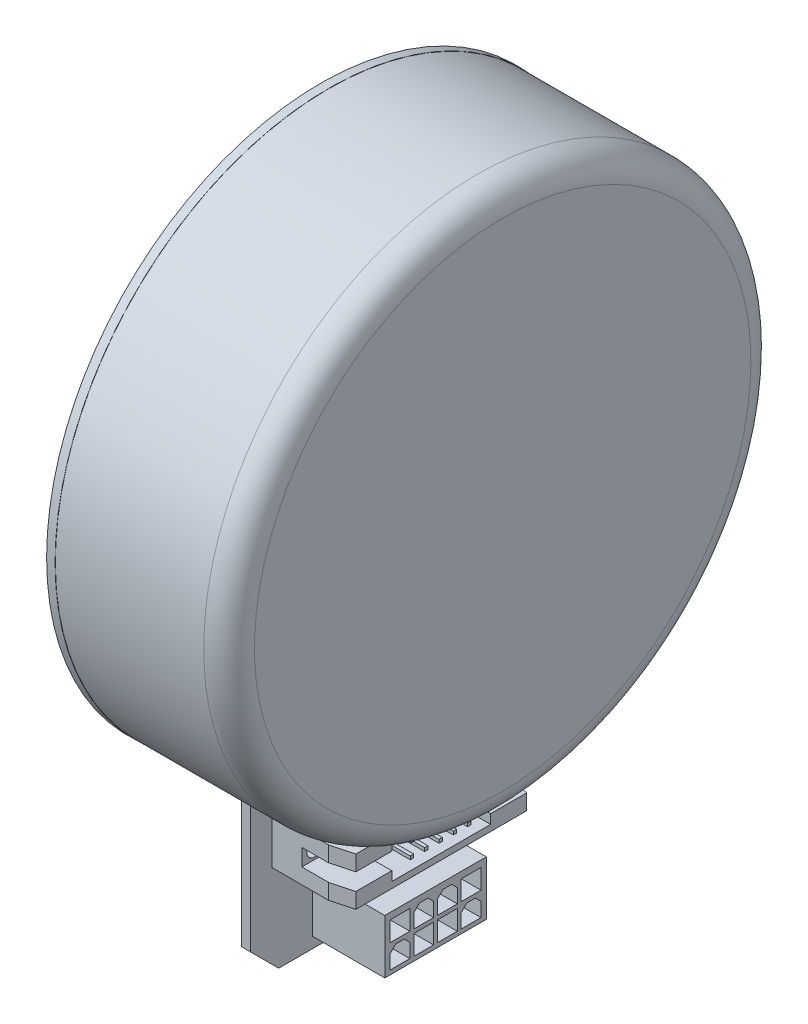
SolidWorks part; units mm, degrees
ref_plane "Front Plane" through (0, 0, 0) normal (0, 0, 1) x (1, 0, 0)
ref_plane "Top Plane" through (0, 0, 0) normal (0, 1, 0) x (1, 0, 0)
ref_plane "Right Plane" through (0, 0, 0) normal (1, 0, 0) x (0, 0, -1)
ref_plane "Plane1" through (7.6, 0, 0) normal (1, 0, 0) x (0, 0, -1)
sketch "Sketch1" plane through (7.6, 0, 0) normal (1, 0, 0) x (0, 0, -1)
  line L0 (-20, -44.1843) -> (20, -44.1843)
  arc A0 (20, -44.1843) -> (-20, -44.1843) centre (0, 0) ccw
extrude "Boss-Extrude1" add sketch "Sketch1" against normal blind 1.6
sketch "Sketch2" plane through (0, -44.1843, 0) normal (0, -1, 0) x (1, 0, 0)
  line L0 (7.6, 20) -> (7.6, -20)
  line L1 (7.6, -20) -> (6, -20)
  line L2 (6, -20) -> (6, 20)
  line L3 (6, 20) -> (7.6, 20)
extrude "Boss-Extrude2" add sketch "Sketch2" along normal blind 31.3157
sketch "Sketch3" plane through (7.6, 0, 0) normal (1, 0, 0) x (0, 0, -1)
  line L0 (-20, -51.5) -> (20, -51.5)
  line L1 (20, -51.5) -> (20, -75.5)
  line L2 (20, -75.5) -> (-20, -75.5)
  line L3 (-20, -75.5) -> (-20, -51.5)
extrude "Boss-Extrude3" add sketch "Sketch3" along normal blind 12.8
ref_plane "Plane2" through (0, 0, -1.7) normal (0, 0, -1) x (-1, 0, 0)
sketch "Sketch4" plane through (0, 0, -1.7) normal (0, 0, -1) x (-1, 0, 0)
  line L0 (-18.4, -75.5) -> (-20.4, -74.1)
  line L1 (-20.4, -74.1) -> (-20.4, -75.5)
  line L2 (-20.4, -75.5) -> (-18.4, -75.5)
extrude "Cut-Extrude1" cut sketch "Sketch4" against normal blind 3.4
sketch "Sketch5" plane through (0, -75.5, 0) normal (0, -1, 0) x (1, 0, 0)
  line L0 (20.4, 1.7) -> (20.4, 20)
  line L1 (20.4, 20) -> (6, 20)
  line L2 (6, 20) -> (6, -20)
  line L3 (6, -20) -> (20.4, -20)
  line L4 (20.4, -20) -> (20.4, -1.7)
  line L5 (20.4, -1.7) -> (17.4, -1.7)
  line L6 (17.4, -1.7) -> (17.4, 1.7)
  line L7 (17.4, 1.7) -> (20.4, 1.7)
extrude "Cut-Extrude2" cut sketch "Sketch5" against normal blind 1.4
sketch "Sketch6" plane through (20.4, 0, 0) normal (1, 0, 0) x (0, 0, -1)
  line L0 (-20, -51.5) -> (20, -51.5)
  line L1 (20, -51.5) -> (20, -74.1)
  line L2 (20, -74.1) -> (-20, -74.1)
  line L3 (-20, -74.1) -> (-20, -51.5)
extrude "Boss-Extrude4" add sketch "Sketch6" along normal blind 1
sketch "Sketch7" plane through (7.6, 0, 0) normal (1, 0, 0) x (0, 0, -1)
  circle A0 centre (0, 0) radius 48.5
extrude "Boss-Extrude5" add sketch "Sketch7" along normal blind 24.7
sketch "Sketch8" plane through (6, 0, 0) normal (-1, 0, 0) x (0, 0, 1)
  line L0 (-20.1, -42.4852) -> (-20.1, -44.1389)
  line L1 (20.1, -44.1389) -> (20.1, -42.4852)
  arc A0 (20.1, -42.4852) -> (-20.1, -42.4852) centre (0, 0) cw
  arc A1 (-20.1, -44.1389) -> (20.1, -44.1389) centre (0, 0) cw
extrude "Boss-Extrude6" add sketch "Sketch8" along normal blind 4.5
sketch "Sketch9" plane through (6, 0, 0) normal (-1, 0, 0) x (0, 0, 1)
  line L0 (-20, -44.1843) -> (-20, -42.5323)
  line L1 (-20.1, -42.4852) -> (-20.1, -44.1389)
  arc A0 (-20.1, -44.1389) -> (-20, -44.1843) centre (0, 0) ccw
  arc A1 (-20, -42.5323) -> (-20.1, -42.4852) centre (0, 0) cw
extrude "Cut-Extrude3" cut sketch "Sketch9" against normal blind 1.6
sketch "Sketch10" plane through (6, 0, 0) normal (-1, 0, 0) x (0, 0, 1)
  line L0 (20, -42.5323) -> (20, -44.1843)
  line L1 (20.1, -44.1389) -> (20.1, -42.4852)
  arc A0 (20, -44.1843) -> (20.1, -44.1389) centre (0, 0) ccw
  arc A1 (20.1, -42.4852) -> (20, -42.5323) centre (0, 0) cw
extrude "Cut-Extrude4" cut sketch "Sketch10" against normal blind 1.6
sketch "Sketch11" plane through (7.6, 0, 0) normal (-1, 0, 0) x (0, 0, 1)
  line L0 (20.1, -44.1389) -> (20.1, -42.4852)
  line L1 (-20.1, -42.4852) -> (-20.1, -44.1389)
  arc A0 (20.1, -42.4852) -> (-20.1, -42.4852) centre (0, 0) cw
  arc A1 (-20.1, -44.1389) -> (20.1, -44.1389) centre (0, 0) ccw
extrude "Cut-Extrude5" cut sketch "Sketch11" against normal blind 0.7
sketch "Sketch12" plane through (0, -51.5, 0) normal (0, 1, 0) x (-1, 0, 0)
  line L0 (-7.6, 3.135) -> (-7.6, 4.485)
  line L1 (-7.6, 4.485) -> (-16.525, 4.485)
  line L2 (-16.525, 3.135) -> (-7.6, 3.135)
  arc A0 (-16.525, 4.485) -> (-16.525, 3.135) centre (-16.525, 3.81) ccw
extrude "Cut-Extrude6" cut sketch "Sketch12" against normal blind 1.1
ref_plane "Plane3" through (0, -52.6, 0) normal (0, 1, 0) x (1, 0, 0)
sketch "Sketch13" plane through (0, -52.6, 0) normal (0, 1, 0) x (1, 0, 0)
  line L0 (15, 8.765) -> (15, -4.485)
  line L1 (15, -4.485) -> (21.4, -4.485)
  line L2 (21.4, -4.485) -> (21.4, 8.765)
  line L3 (21.4, 8.765) -> (15, 8.765)
extrude "Cut-Extrude7" cut sketch "Sketch13" against normal blind 0.9
sketch "Sketch14" plane through (0, 0, 4.485) normal (0, 0, -1) x (-1, 0, 0)
  line L0 (-21.4, -52.6) -> (-21.4, -53.5)
  line L1 (-21.4, -53.5) -> (-15, -53.5)
  line L2 (-15, -53.5) -> (-15, -52.6)
  line L3 (-15, -52.6) -> (-21.4, -52.6)
extrude "Cut-Extrude8" cut sketch "Sketch14" against normal blind 4.28
sketch "Sketch15" plane through (0, 0, 4.485) normal (0, 0, -1) x (-1, 0, 0)
  line L0 (-12.6, -51.5) -> (-12.6, -52.6)
  line L1 (-12.6, -52.6) -> (-7.6, -52.6)
  line L2 (-7.6, -52.6) -> (-7.6, -51.5)
  line L3 (-7.6, -51.5) -> (-12.6, -51.5)
extrude "Cut-Extrude9" cut sketch "Sketch15" against normal blind 2.515
sketch "Sketch16" plane through (0, 0, 3.135) normal (0, 0, 1) x (1, 0, 0)
  line L0 (7.6, -52.6) -> (12.6, -52.6)
  line L1 (12.6, -52.6) -> (12.6, -51.5)
  line L2 (12.6, -51.5) -> (7.6, -51.5)
  line L3 (7.6, -51.5) -> (7.6, -52.6)
extrude "Cut-Extrude10" cut sketch "Sketch16" against normal blind 10.135
sketch "Sketch17" plane through (0, 0, 3.135) normal (0, 0, 1) x (1, 0, 0)
  line L0 (14.2, -52.6) -> (14.2, -51.5)
  line L1 (14.2, -51.5) -> (12.6, -51.5)
  line L2 (12.6, -51.5) -> (12.6, -52.6)
  line L3 (12.6, -52.6) -> (14.2, -52.6)
extrude "Cut-Extrude11" cut sketch "Sketch17" against normal blind 1.085
sketch "Sketch18" plane through (0, 0, 2.05) normal (0, 0, 1) x (1, 0, 0)
  line L0 (21.4, -51.5) -> (12.6, -51.5)
  line L1 (12.6, -51.5) -> (12.6, -52.6)
  line L2 (12.6, -52.6) -> (14, -52.6)
  line L3 (14, -52.6) -> (14, -53.5)
  line L4 (14, -53.5) -> (15, -53.5)
  line L5 (15, -53.5) -> (15, -52.6)
  line L6 (15, -52.6) -> (21.4, -52.6)
  line L7 (21.4, -52.6) -> (21.4, -51.5)
extrude "Cut-Extrude12" cut sketch "Sketch18" against normal blind 0.24
sketch "Sketch19" plane through (0, 0, 1.81) normal (0, 0, 1) x (1, 0, 0)
  line L0 (14, -51.5) -> (14, -53.5)
  line L1 (14, -53.5) -> (15, -53.5)
  line L2 (15, -53.5) -> (15, -52.6)
  line L3 (15, -52.6) -> (21.4, -52.6)
  line L4 (21.4, -52.6) -> (21.4, -51.5)
  line L5 (21.4, -51.5) -> (14, -51.5)
extrude "Cut-Extrude13" cut sketch "Sketch19" against normal blind 3.86
sketch "Sketch20" plane through (0, -53.5, 0) normal (0, 1, 0) x (-1, 0, 0)
  line L0 (-21.4, 8.765) -> (-21.4, -8.765)
  line L1 (-21.4, -8.765) -> (-15, -8.765)
  line L2 (-15, -8.765) -> (-15, 8.765)
  line L3 (-15, 8.765) -> (-21.4, 8.765)
extrude "Cut-Extrude14" cut sketch "Sketch20" against normal blind 0.75
sketch "Sketch21" plane through (0, -54.25, 0) normal (0, 1, 0) x (-1, 0, 0)
  line L0 (-15, -6.45) -> (-15, 8.765)
  line L1 (-15, 8.765) -> (-21.4, 8.765)
  line L2 (-21.4, 8.765) -> (-21.4, -20)
  line L3 (-21.4, -20) -> (-12.85, -20)
  line L4 (-12.85, -20) -> (-12.85, -6.45)
  line L5 (-12.85, -6.45) -> (-15, -6.45)
extrude "Cut-Extrude15" cut sketch "Sketch21" against normal blind 3
ref_plane "Plane4" through (0, -57.25, 0) normal (0, -1, 0) x (1, 0, 0)
sketch "Sketch22" plane through (0, -57.25, 0) normal (0, -1, 0) x (1, 0, 0)
  line L0 (12.85, 13.7429) -> (12.85, 6.45)
  line L1 (12.85, 6.45) -> (15, 6.45)
  line L2 (15, 6.45) -> (15, 8.765)
  line L3 (15, 8.765) -> (21.4, 8.765)
  line L4 (21.4, 8.765) -> (21.4, 20)
  line L5 (21.4, 20) -> (12.85, 20)
  line L6 (12.85, 16.15) -> (12.85, 14.1972)
  spline S0 degree 3 poles (12.85, 20) (12.85, 18.7167) (12.85, 17.4333) (12.85, 16.15) knots 0 0 0 0 1 1 1 1
  spline S1 degree 3 poles (12.85, 14.1972) (12.85, 14.0457) (12.85, 13.8943) (12.85, 13.7429) knots 0 0 0 0 1 1 1 1
extrude "Cut-Extrude16" cut sketch "Sketch22" against normal blind 3
sketch "Sketch23" plane through (0, -52.6, 0) normal (0, 1, 0) x (-1, 0, 0)
  line L0 (-12.6, -7) -> (-7.6, -7)
  line L1 (-7.6, -7) -> (-7.6, 7)
  line L2 (-7.6, 7) -> (-12.6, 7)
  line L3 (-12.6, 7) -> (-12.6, -7)
extrude "Cut-Extrude17" cut sketch "Sketch23" against normal blind 0.1
sketch "Sketch24" plane through (0, -51.5, 0) normal (0, 1, 0) x (-1, 0, 0)
  line L0 (-11.9551, 8.32) -> (-7.6, 8.32)
  line L1 (-7.6, 8.32) -> (-7.6, 13.52)
  line L2 (-7.6, 13.52) -> (-11.9551, 13.52)
  line L3 (-11.9551, 13.52) -> (-13.4562, 10.92)
  line L4 (-13.4562, 10.92) -> (-11.9551, 8.32)
extrude "Cut-Extrude18" cut sketch "Sketch24" against normal blind 1.7
sketch "Sketch25" plane through (0, -51.5, 0) normal (0, 1, 0) x (-1, 0, 0)
  line L0 (-11.9551, -13.52) -> (-7.6, -13.52)
  line L1 (-7.6, -13.52) -> (-7.6, -8.32)
  line L2 (-7.6, -8.32) -> (-11.9551, -8.32)
  line L3 (-11.9551, -8.32) -> (-13.4562, -10.92)
  line L4 (-13.4562, -10.92) -> (-11.9551, -13.52)
extrude "Cut-Extrude19" cut sketch "Sketch25" against normal blind 1.7
sketch "Sketch26" plane through (0, 0, -20) normal (0, 0, -1) x (-1, 0, 0)
  line L0 (-7.6, -51.5) -> (-21.4, -51.5)
  line L1 (-21.4, -51.5) -> (-21.4, -54.25)
  line L2 (-21.4, -54.25) -> (-12.85, -54.25)
  line L3 (-12.85, -54.25) -> (-12.85, -57.25)
  line L4 (-12.85, -57.25) -> (-21.4, -57.25)
  line L5 (-21.4, -57.25) -> (-21.4, -74.1)
  line L6 (-21.4, -74.1) -> (-7.6, -74.1)
  line L7 (-7.6, -74.1) -> (-7.6, -51.5)
extrude "Cut-Extrude20" cut sketch "Sketch26" against normal blind 3.85
sketch "Sketch27" plane through (0, -51.5, 0) normal (0, 1, 0) x (-1, 0, 0)
  line L0 (-21.4, 5.81) -> (-21.4, 2.05)
  line L1 (-21.4, 2.05) -> (-14.2, 2.05)
  line L2 (-14.2, 2.05) -> (-14.2, 3.135)
  line L3 (-14.2, 3.135) -> (-16.525, 3.135)
  line L4 (-16.525, 4.485) -> (-14.2, 4.485)
  line L5 (-12.6, 4.485) -> (-12.6, 5.81)
  line L6 (-12.6, 5.81) -> (-21.4, 5.81)
  arc A0 (-16.525, 3.135) -> (-16.525, 4.485) centre (-16.525, 3.81) cw
  spline S0 degree 3 poles (-12.6, 4.485) (-13.1333, 4.485) (-13.6667, 4.485) (-14.2, 4.485) knots 0 0 0 0 1 1 1 1
extrude "Cut-Extrude21" cut sketch "Sketch27" against normal blind 0.4
sketch "Sketch28" plane through (0, 0, 20) normal (0, 0, 1) x (1, 0, 0)
  line L0 (12.85, -54.25) -> (21.4, -54.25)
  line L1 (21.4, -54.25) -> (21.4, -51.5)
  line L2 (21.4, -51.5) -> (7.6, -51.5)
  line L3 (7.6, -51.5) -> (7.6, -74.1)
  line L4 (7.6, -74.1) -> (21.4, -74.1)
  line L5 (21.4, -74.1) -> (21.4, -57.25)
  line L6 (21.4, -57.25) -> (12.85, -57.25)
  line L7 (12.85, -57.25) -> (12.85, -54.25)
extrude "Cut-Extrude22" cut sketch "Sketch28" against normal blind 3.85
sketch "Sketch29" plane through (0, -74.1, 0) normal (0, -1, 0) x (1, 0, 0)
  line L0 (7.6, 9) -> (20.4, 9)
  line L1 (20.4, 9) -> (20.4, -9)
  line L2 (20.4, -9) -> (7.6, -9)
  line L3 (7.6, -9) -> (7.6, -16.15)
  line L4 (7.6, -16.15) -> (21.4, -16.15)
  line L5 (21.4, -16.15) -> (21.4, 16.15)
  line L6 (21.4, 16.15) -> (7.6, 16.15)
  line L7 (7.6, 16.15) -> (7.6, 9)
extrude "Cut-Extrude23" cut sketch "Sketch29" against normal blind 9.6
ref_plane "Plane5" through (0, -58.52, 0) normal (0, 1, 0) x (1, 0, 0)
sketch "Sketch30" plane through (0, -58.52, 0) normal (0, 1, 0) x (1, 0, 0)
  line L0 (7.6, -7.5) -> (12.7, -7.5)
  line L1 (12.7, -7.5) -> (12.7, 7.5)
  line L2 (12.7, 7.5) -> (7.6, 7.5)
  line L3 (7.6, 7.5) -> (7.6, -7.5)
extrude "Cut-Extrude24" cut sketch "Sketch30" against normal blind 5.98
sketch "Sketch31" plane through (0, -64.5, 0) normal (0, -1, 0) x (1, 0, 0)
  line L0 (7.6, 16.15) -> (7.6, 7.5)
  line L1 (7.6, 7.5) -> (12.7, 7.5)
  line L2 (12.7, 7.5) -> (12.7, -7.5)
  line L3 (12.7, -7.5) -> (7.6, -7.5)
  line L4 (7.6, -7.5) -> (7.6, -16.15)
  line L5 (7.6, -16.15) -> (21.4, -16.15)
  line L6 (21.4, -16.15) -> (21.4, 16.15)
  line L7 (21.4, 16.15) -> (7.6, 16.15)
extrude "Cut-Extrude25" cut sketch "Sketch31" against normal blind 4.5
sketch "Sketch32" plane through (0, -74.1, 0) normal (0, -1, 0) x (1, 0, 0)
  line L0 (6, -20) -> (6, 20)
  line L1 (6, 20) -> (7.6, 20)
  line L2 (7.6, 20) -> (7.6, -20)
  line L3 (7.6, -20) -> (6, -20)
extrude "Boss-Extrude7" add sketch "Sketch32" along normal blind 1.9
ref_plane "Plane6" through (1.5, 0, 0) normal (1, 0, 0) x (0, 0, -1)
sketch "Sketch33" plane through (1.5, 0, 0) normal (1, 0, 0) x (0, 0, -1)
  circle A0 centre (0, 0) radius 48.55
extrude "Boss-Extrude8" add sketch "Sketch33" against normal blind 1.5
sketch "Sketch34" plane through (0, -54.25, 0) normal (0, -1, 0) x (1, 0, 0)
  line L0 (12.85, -12.95) -> (12.85, -6.45)
  line L1 (12.85, -6.45) -> (13.6, -6.45)
  line L2 (13.6, -6.45) -> (13.6, -12.95)
  line L3 (13.6, -12.95) -> (12.85, -12.95)
extrude "Boss-Extrude9" add sketch "Sketch34" along normal blind 3
sketch "Sketch35" plane through (13.6, 0, 0) normal (1, 0, 0) x (0, 0, -1)
  line L0 (6.45, -54.25) -> (6.45, -57.25)
  line L1 (6.45, -57.25) -> (9.65, -57.25)
  line L2 (9.65, -57.25) -> (9.65, -54.25)
  line L3 (9.65, -54.25) -> (6.45, -54.25)
extrude "Cut-Extrude26" cut sketch "Sketch35" against normal blind 1.25
sketch "Sketch36" plane through (0, -57.25, 0) normal (0, 1, 0) x (-1, 0, 0)
  line L0 (-13.6, 12.95) -> (-12.85, 12.95)
  line L1 (-12.85, 12.95) -> (-12.85, 6.45)
  line L2 (-12.85, 6.45) -> (-13.6, 6.45)
  line L3 (-13.6, 6.45) -> (-13.6, 12.95)
extrude "Boss-Extrude10" add sketch "Sketch36" along normal blind 3
sketch "Sketch37" plane through (13.6, 0, 0) normal (1, 0, 0) x (0, 0, -1)
  line L0 (-6.45, -54.25) -> (-11.75, -54.25)
  line L1 (-11.75, -54.25) -> (-11.75, -57.25)
  line L2 (-11.75, -57.25) -> (-6.45, -57.25)
  line L3 (-6.45, -57.25) -> (-6.45, -54.25)
extrude "Cut-Extrude27" cut sketch "Sketch37" against normal blind 1.25
sketch "Sketch38" plane through (12.6, 0, 0) normal (-1, 0, 0) x (0, 0, 1)
  line L0 (5.81, -52.6) -> (5.81, -51.9)
  line L1 (5.81, -51.9) -> (4.485, -51.9)
  line L2 (4.485, -51.9) -> (4.485, -52.6)
  line L3 (4.485, -52.6) -> (5.81, -52.6)
extrude "Cut-Extrude28" cut sketch "Sketch38" against normal blind 1.6
sketch "Sketch39" plane through (0, -57.25, 0) normal (0, 1, 0) x (-1, 0, 0)
  line L0 (-15, -8.765) -> (-15, 8.765)
  line L1 (-15, 8.765) -> (-21.4, 8.765)
  line L2 (-21.4, 8.765) -> (-21.4, -8.765)
  line L3 (-21.4, -8.765) -> (-15, -8.765)
extrude "Cut-Extrude29" cut sketch "Sketch39" against normal blind 1.65
sketch "Sketch40" plane through (0, -51.9, 0) normal (0, 1, 0) x (-1, 0, 0)
  line L0 (-21.4, 2.81) -> (-20.4, 2.81)
  line L1 (-20.4, 2.81) -> (-20.4, 4.81)
  line L2 (-20.4, 4.81) -> (-21.4, 4.81)
  line L3 (-21.4, 4.81) -> (-21.4, 2.81)
extrude "Cut-Extrude30" cut sketch "Sketch40" against normal up to next
sketch "Sketch41" plane through (20.4, 0, 0) normal (1, 0, 0) x (0, 0, -1)
  line L0 (-8.05, -69.15) -> (-4.55, -69.15)
  line L1 (-4.55, -69.15) -> (-4.55, -65.65)
  line L2 (-4.55, -65.65) -> (-8.05, -65.65)
  line L3 (-8.05, -65.65) -> (-8.05, -69.15)
extrude "Cut-Extrude31" cut sketch "Sketch41" against normal blind 12.8
sketch "Sketch42" plane through (7.6, 0, 0) normal (1, 0, 0) x (0, 0, -1)
  line L0 (-5.8151, -67.9698) -> (-6.7849, -67.9698)
  line L1 (-6.7849, -67.9698) -> (-6.7849, -67)
  line L2 (-6.7849, -67) -> (-5.8151, -67)
  line L3 (-5.8151, -67) -> (-5.8151, -67.9698)
extrude "Boss-Extrude11" add sketch "Sketch42" along normal blind 3
sketch "Sketch43" plane through (20.4, 0, 0) normal (1, 0, 0) x (0, 0, -1)
  line L0 (4.55, -69.15) -> (8.05, -69.15)
  line L1 (8.05, -69.15) -> (8.05, -65.65)
  line L2 (8.05, -65.65) -> (4.55, -65.65)
  line L3 (4.55, -65.65) -> (4.55, -69.15)
extrude "Cut-Extrude32" cut sketch "Sketch43" against normal blind 12.8
sketch "Sketch44" plane through (7.6, 0, 0) normal (1, 0, 0) x (0, 0, -1)
  line L0 (6.7849, -67.9698) -> (5.8151, -67.9698)
  line L1 (5.8151, -67.9698) -> (5.8151, -67)
  line L2 (5.8151, -67) -> (6.7849, -67)
  line L3 (6.7849, -67) -> (6.7849, -67.9698)
extrude "Boss-Extrude12" add sketch "Sketch44" along normal blind 3
sketch "Sketch45" plane through (20.4, 0, 0) normal (1, 0, 0) x (0, 0, -1)
  line L0 (-3.85, -73.35) -> (-0.35, -73.35)
  line L1 (-0.35, -73.35) -> (-0.35, -69.85)
  line L2 (-0.35, -69.85) -> (-3.85, -69.85)
  line L3 (-3.85, -69.85) -> (-3.85, -73.35)
extrude "Cut-Extrude33" cut sketch "Sketch45" against normal blind 12.8
sketch "Sketch46" plane through (7.6, 0, 0) normal (1, 0, 0) x (0, 0, -1)
  line L0 (-1.6151, -72.1698) -> (-2.5849, -72.1698)
  line L1 (-2.5849, -72.1698) -> (-2.5849, -71.2)
  line L2 (-2.5849, -71.2) -> (-1.6151, -71.2)
  line L3 (-1.6151, -71.2) -> (-1.6151, -72.1698)
extrude "Boss-Extrude13" add sketch "Sketch46" along normal blind 3
sketch "Sketch47" plane through (20.4, 0, 0) normal (1, 0, 0) x (0, 0, -1)
  line L0 (0.35, -73.35) -> (3.85, -73.35)
  line L1 (3.85, -73.35) -> (3.85, -69.85)
  line L2 (3.85, -69.85) -> (0.35, -69.85)
  line L3 (0.35, -69.85) -> (0.35, -73.35)
extrude "Cut-Extrude34" cut sketch "Sketch47" against normal blind 12.8
sketch "Sketch48" plane through (7.6, 0, 0) normal (1, 0, 0) x (0, 0, -1)
  line L0 (2.5849, -72.1698) -> (1.6151, -72.1698)
  line L1 (1.6151, -72.1698) -> (1.6151, -71.2)
  line L2 (1.6151, -71.2) -> (2.5849, -71.2)
  line L3 (2.5849, -71.2) -> (2.5849, -72.1698)
extrude "Boss-Extrude14" add sketch "Sketch48" along normal blind 3
sketch "Sketch49" plane through (20.4, 0, 0) normal (1, 0, 0) x (0, 0, -1)
  line L0 (0.35, -65.65) -> (0.35, -69.15)
  line L1 (0.35, -69.15) -> (3.85, -69.15)
  line L2 (3.85, -69.15) -> (3.85, -65.65)
  line L3 (3.85, -65.65) -> (0.35, -65.65)
extrude "Cut-Extrude35" cut sketch "Sketch49" against normal blind 12.8
sketch "Sketch50" plane through (7.6, 0, 0) normal (1, 0, 0) x (0, 0, -1)
  line L0 (2.5849, -67.9698) -> (1.6151, -67.9698)
  line L1 (1.6151, -67.9698) -> (1.6151, -67)
  line L2 (1.6151, -67) -> (2.5849, -67)
  line L3 (2.5849, -67) -> (2.5849, -67.9698)
extrude "Boss-Extrude15" add sketch "Sketch50" along normal blind 3
sketch "Sketch51" plane through (20.4, 0, 0) normal (1, 0, 0) x (0, 0, -1)
  line L0 (-3.85, -65.65) -> (-3.85, -69.15)
  line L1 (-3.85, -69.15) -> (-0.35, -69.15)
  line L2 (-0.35, -69.15) -> (-0.35, -65.65)
  line L3 (-0.35, -65.65) -> (-3.85, -65.65)
extrude "Cut-Extrude36" cut sketch "Sketch51" against normal blind 12.8
sketch "Sketch52" plane through (7.6, 0, 0) normal (1, 0, 0) x (0, 0, -1)
  line L0 (-1.6151, -67.9698) -> (-2.5849, -67.9698)
  line L1 (-2.5849, -67.9698) -> (-2.5849, -67)
  line L2 (-2.5849, -67) -> (-1.6151, -67)
  line L3 (-1.6151, -67) -> (-1.6151, -67.9698)
extrude "Boss-Extrude16" add sketch "Sketch52" along normal blind 3
sketch "Sketch53" plane through (20.4, 0, 0) normal (1, 0, 0) x (0, 0, -1)
  line L0 (-8.05, -73.35) -> (-4.55, -73.35)
  line L1 (-4.55, -73.35) -> (-4.55, -69.85)
  line L2 (-4.55, -69.85) -> (-8.05, -69.85)
  line L3 (-8.05, -69.85) -> (-8.05, -73.35)
extrude "Cut-Extrude37" cut sketch "Sketch53" against normal blind 12.8
sketch "Sketch54" plane through (7.6, 0, 0) normal (1, 0, 0) x (0, 0, -1)
  line L0 (-5.8151, -72.1698) -> (-6.7849, -72.1698)
  line L1 (-6.7849, -72.1698) -> (-6.7849, -71.2)
  line L2 (-6.7849, -71.2) -> (-5.8151, -71.2)
  line L3 (-5.8151, -71.2) -> (-5.8151, -72.1698)
extrude "Boss-Extrude17" add sketch "Sketch54" along normal blind 3
sketch "Sketch55" plane through (20.4, 0, 0) normal (1, 0, 0) x (0, 0, -1)
  line L0 (4.55, -73.35) -> (8.05, -73.35)
  line L1 (8.05, -73.35) -> (8.05, -69.85)
  line L2 (8.05, -69.85) -> (4.55, -69.85)
  line L3 (4.55, -69.85) -> (4.55, -73.35)
extrude "Cut-Extrude38" cut sketch "Sketch55" against normal blind 12.8
sketch "Sketch56" plane through (7.6, 0, 0) normal (1, 0, 0) x (0, 0, -1)
  line L0 (6.7849, -72.1698) -> (5.8151, -72.1698)
  line L1 (5.8151, -72.1698) -> (5.8151, -71.2)
  line L2 (5.8151, -71.2) -> (6.7849, -71.2)
  line L3 (6.7849, -71.2) -> (6.7849, -72.1698)
extrude "Boss-Extrude18" add sketch "Sketch56" along normal blind 3
sketch "Sketch57" plane through (15, 0, 0) normal (1, 0, 0) x (0, 0, -1)
  line L0 (-2.84, -54.18) -> (-2.24, -54.18)
  line L1 (-2.24, -54.18) -> (-2.24, -54.78)
  line L2 (-2.24, -54.78) -> (-2.84, -54.78)
  line L3 (-2.84, -54.78) -> (-2.84, -54.18)
extrude "Boss-Extrude19" add sketch "Sketch57" along normal blind 6.3
sketch "Sketch58" plane through (15, 0, 0) normal (1, 0, 0) x (0, 0, -1)
  line L0 (-2.84, -56.72) -> (-2.24, -56.72)
  line L1 (-2.24, -56.72) -> (-2.24, -57.32)
  line L2 (-2.24, -57.32) -> (-2.84, -57.32)
  line L3 (-2.84, -57.32) -> (-2.84, -56.72)
extrude "Boss-Extrude20" add sketch "Sketch58" along normal blind 6.3
sketch "Sketch59" plane through (15, 0, 0) normal (1, 0, 0) x (0, 0, -1)
  line L0 (-0.3, -54.18) -> (0.3, -54.18)
  line L1 (0.3, -54.18) -> (0.3, -54.78)
  line L2 (0.3, -54.78) -> (-0.3, -54.78)
  line L3 (-0.3, -54.78) -> (-0.3, -54.18)
extrude "Boss-Extrude21" add sketch "Sketch59" along normal blind 6.3
sketch "Sketch60" plane through (15, 0, 0) normal (1, 0, 0) x (0, 0, -1)
  line L0 (-0.3, -56.72) -> (0.3, -56.72)
  line L1 (0.3, -56.72) -> (0.3, -57.32)
  line L2 (0.3, -57.32) -> (-0.3, -57.32)
  line L3 (-0.3, -57.32) -> (-0.3, -56.72)
extrude "Boss-Extrude22" add sketch "Sketch60" along normal blind 6.3
sketch "Sketch61" plane through (15, 0, 0) normal (1, 0, 0) x (0, 0, -1)
  line L0 (2.24, -56.72) -> (2.84, -56.72)
  line L1 (2.84, -56.72) -> (2.84, -57.32)
  line L2 (2.84, -57.32) -> (2.24, -57.32)
  line L3 (2.24, -57.32) -> (2.24, -56.72)
extrude "Boss-Extrude23" add sketch "Sketch61" along normal blind 6.3
sketch "Sketch62" plane through (15, 0, 0) normal (1, 0, 0) x (0, 0, -1)
  line L0 (2.24, -54.18) -> (2.84, -54.18)
  line L1 (2.84, -54.18) -> (2.84, -54.78)
  line L2 (2.84, -54.78) -> (2.24, -54.78)
  line L3 (2.24, -54.78) -> (2.24, -54.18)
extrude "Boss-Extrude24" add sketch "Sketch62" along normal blind 6.3
sketch "Sketch63" plane through (15, 0, 0) normal (1, 0, 0) x (0, 0, -1)
  line L0 (4.78, -57.32) -> (4.78, -56.72)
  line L1 (4.78, -56.72) -> (5.38, -56.72)
  line L2 (5.38, -56.72) -> (5.38, -57.32)
  line L3 (5.38, -57.32) -> (4.78, -57.32)
extrude "Boss-Extrude25" add sketch "Sketch63" along normal blind 6.3
sketch "Sketch64" plane through (15, 0, 0) normal (1, 0, 0) x (0, 0, -1)
  line L0 (-5.38, -57.32) -> (-5.38, -56.72)
  line L1 (-5.38, -56.72) -> (-4.78, -56.72)
  line L2 (-4.78, -56.72) -> (-4.78, -57.32)
  line L3 (-4.78, -57.32) -> (-5.38, -57.32)
extrude "Boss-Extrude26" add sketch "Sketch64" along normal blind 6.3
sketch "Sketch65" plane through (15, 0, 0) normal (1, 0, 0) x (0, 0, -1)
  line L0 (4.78, -54.78) -> (4.78, -54.18)
  line L1 (4.78, -54.18) -> (5.38, -54.18)
  line L2 (5.38, -54.18) -> (5.38, -54.78)
  line L3 (5.38, -54.78) -> (4.78, -54.78)
extrude "Boss-Extrude27" add sketch "Sketch65" along normal blind 6.3
sketch "Sketch66" plane through (15, 0, 0) normal (1, 0, 0) x (0, 0, -1)
  line L0 (-5.38, -54.78) -> (-5.38, -54.18)
  line L1 (-5.38, -54.18) -> (-4.78, -54.18)
  line L2 (-4.78, -54.18) -> (-4.78, -54.78)
  line L3 (-4.78, -54.78) -> (-5.38, -54.78)
extrude "Boss-Extrude28" add sketch "Sketch66" along normal blind 6.3
sketch "Sketch67" plane through (6, 0, 0) normal (-1, 0, 0) x (0, 0, 1)
  line L0 (-4.78, -54.18) -> (-4.78, -54.78)
  line L1 (-4.78, -54.78) -> (-5.38, -54.78)
  line L2 (-5.38, -54.78) -> (-5.38, -54.18)
  line L3 (-5.38, -54.18) -> (-4.78, -54.18)
extrude "Boss-Extrude29" add sketch "Sketch67" along normal blind 1.6
sketch "Sketch68" plane through (6, 0, 0) normal (-1, 0, 0) x (0, 0, 1)
  line L0 (-2.84, -54.78) -> (-2.84, -54.18)
  line L1 (-2.84, -54.18) -> (-2.24, -54.18)
  line L2 (-2.24, -54.18) -> (-2.24, -54.78)
  line L3 (-2.24, -54.78) -> (-2.84, -54.78)
extrude "Boss-Extrude30" add sketch "Sketch68" along normal blind 1.6
sketch "Sketch69" plane through (6, 0, 0) normal (-1, 0, 0) x (0, 0, 1)
  line L0 (-0.3, -54.78) -> (-0.3, -54.18)
  line L1 (-0.3, -54.18) -> (0.3, -54.18)
  line L2 (0.3, -54.18) -> (0.3, -54.78)
  line L3 (0.3, -54.78) -> (-0.3, -54.78)
extrude "Boss-Extrude31" add sketch "Sketch69" along normal blind 1.6
sketch "Sketch70" plane through (6, 0, 0) normal (-1, 0, 0) x (0, 0, 1)
  line L0 (2.24, -54.78) -> (2.24, -54.18)
  line L1 (2.24, -54.18) -> (2.84, -54.18)
  line L2 (2.84, -54.18) -> (2.84, -54.78)
  line L3 (2.84, -54.78) -> (2.24, -54.78)
extrude "Boss-Extrude32" add sketch "Sketch70" along normal blind 1.6
sketch "Sketch71" plane through (6, 0, 0) normal (-1, 0, 0) x (0, 0, 1)
  line L0 (4.78, -54.18) -> (5.38, -54.18)
  line L1 (5.38, -54.18) -> (5.38, -54.78)
  line L2 (5.38, -54.78) -> (4.78, -54.78)
  line L3 (4.78, -54.78) -> (4.78, -54.18)
extrude "Boss-Extrude33" add sketch "Sketch71" along normal blind 1.6
sketch "Sketch72" plane through (6, 0, 0) normal (-1, 0, 0) x (0, 0, 1)
  line L0 (4.78, -56.72) -> (5.38, -56.72)
  line L1 (5.38, -56.72) -> (5.38, -57.32)
  line L2 (5.38, -57.32) -> (4.78, -57.32)
  line L3 (4.78, -57.32) -> (4.78, -56.72)
extrude "Boss-Extrude34" add sketch "Sketch72" along normal blind 1.6
sketch "Sketch73" plane through (6, 0, 0) normal (-1, 0, 0) x (0, 0, 1)
  line L0 (2.24, -57.32) -> (2.24, -56.72)
  line L1 (2.24, -56.72) -> (2.84, -56.72)
  line L2 (2.84, -56.72) -> (2.84, -57.32)
  line L3 (2.84, -57.32) -> (2.24, -57.32)
extrude "Boss-Extrude35" add sketch "Sketch73" along normal blind 1.6
sketch "Sketch74" plane through (6, 0, 0) normal (-1, 0, 0) x (0, 0, 1)
  line L0 (-0.3, -57.32) -> (-0.3, -56.72)
  line L1 (-0.3, -56.72) -> (0.3, -56.72)
  line L2 (0.3, -56.72) -> (0.3, -57.32)
  line L3 (0.3, -57.32) -> (-0.3, -57.32)
extrude "Boss-Extrude36" add sketch "Sketch74" along normal blind 1.6
sketch "Sketch75" plane through (6, 0, 0) normal (-1, 0, 0) x (0, 0, 1)
  line L0 (-2.84, -57.32) -> (-2.84, -56.72)
  line L1 (-2.84, -56.72) -> (-2.24, -56.72)
  line L2 (-2.24, -56.72) -> (-2.24, -57.32)
  line L3 (-2.24, -57.32) -> (-2.84, -57.32)
extrude "Boss-Extrude37" add sketch "Sketch75" along normal blind 1.6
sketch "Sketch76" plane through (6, 0, 0) normal (-1, 0, 0) x (0, 0, 1)
  line L0 (-4.78, -56.72) -> (-4.78, -57.32)
  line L1 (-4.78, -57.32) -> (-5.38, -57.32)
  line L2 (-5.38, -57.32) -> (-5.38, -56.72)
  line L3 (-5.38, -56.72) -> (-4.78, -56.72)
extrude "Boss-Extrude38" add sketch "Sketch76" along normal blind 1.6
sketch "Sketch77" plane through (6, 0, 0) normal (-1, 0, 0) x (0, 0, 1)
  line L0 (-5.8151, -71.2) -> (-5.8151, -72.1698)
  line L1 (-5.8151, -72.1698) -> (-6.7849, -72.1698)
  line L2 (-6.7849, -72.1698) -> (-6.7849, -71.2)
  line L3 (-6.7849, -71.2) -> (-5.8151, -71.2)
extrude "Boss-Extrude39" add sketch "Sketch77" along normal blind 1.4
sketch "Sketch78" plane through (6, 0, 0) normal (-1, 0, 0) x (0, 0, 1)
  line L0 (-1.6151, -71.2) -> (-1.6151, -72.1698)
  line L1 (-1.6151, -72.1698) -> (-2.5849, -72.1698)
  line L2 (-2.5849, -72.1698) -> (-2.5849, -71.2)
  line L3 (-2.5849, -71.2) -> (-1.6151, -71.2)
extrude "Boss-Extrude40" add sketch "Sketch78" along normal blind 1.4
sketch "Sketch79" plane through (6, 0, 0) normal (-1, 0, 0) x (0, 0, 1)
  line L0 (2.5849, -71.2) -> (2.5849, -72.1698)
  line L1 (2.5849, -72.1698) -> (1.6151, -72.1698)
  line L2 (1.6151, -72.1698) -> (1.6151, -71.2)
  line L3 (1.6151, -71.2) -> (2.5849, -71.2)
extrude "Boss-Extrude41" add sketch "Sketch79" along normal blind 1.4
sketch "Sketch80" plane through (6, 0, 0) normal (-1, 0, 0) x (0, 0, 1)
  line L0 (6.7849, -71.2) -> (6.7849, -72.1698)
  line L1 (6.7849, -72.1698) -> (5.8151, -72.1698)
  line L2 (5.8151, -72.1698) -> (5.8151, -71.2)
  line L3 (5.8151, -71.2) -> (6.7849, -71.2)
extrude "Boss-Extrude42" add sketch "Sketch80" along normal blind 1.4
sketch "Sketch81" plane through (6, 0, 0) normal (-1, 0, 0) x (0, 0, 1)
  line L0 (-5.8151, -67) -> (-5.8151, -67.9698)
  line L1 (-5.8151, -67.9698) -> (-6.7849, -67.9698)
  line L2 (-6.7849, -67.9698) -> (-6.7849, -67)
  line L3 (-6.7849, -67) -> (-5.8151, -67)
extrude "Boss-Extrude43" add sketch "Sketch81" along normal blind 1.4
sketch "Sketch82" plane through (6, 0, 0) normal (-1, 0, 0) x (0, 0, 1)
  line L0 (-1.6151, -67) -> (-1.6151, -67.9698)
  line L1 (-1.6151, -67.9698) -> (-2.5849, -67.9698)
  line L2 (-2.5849, -67.9698) -> (-2.5849, -67)
  line L3 (-2.5849, -67) -> (-1.6151, -67)
extrude "Boss-Extrude44" add sketch "Sketch82" along normal blind 1.4
sketch "Sketch83" plane through (6, 0, 0) normal (-1, 0, 0) x (0, 0, 1)
  line L0 (2.5849, -67) -> (2.5849, -67.9698)
  line L1 (2.5849, -67.9698) -> (1.6151, -67.9698)
  line L2 (1.6151, -67.9698) -> (1.6151, -67)
  line L3 (1.6151, -67) -> (2.5849, -67)
extrude "Boss-Extrude45" add sketch "Sketch83" along normal blind 1.4
sketch "Sketch84" plane through (6, 0, 0) normal (-1, 0, 0) x (0, 0, 1)
  line L0 (6.7849, -67) -> (6.7849, -67.9698)
  line L1 (6.7849, -67.9698) -> (5.8151, -67.9698)
  line L2 (5.8151, -67.9698) -> (5.8151, -67)
  line L3 (5.8151, -67) -> (6.7849, -67)
extrude "Boss-Extrude46" add sketch "Sketch84" along normal blind 1.4
sketch "Sketch85" plane through (0, -51.5, 0) normal (0, 1, 0) x (-1, 0, 0)
  line L0 (-18.6, -5.08) -> (-21.1, -3.83)
  line L1 (-21.1, -3.83) -> (-21.1, -6.33)
  line L2 (-21.1, -6.33) -> (-18.6, -5.08)
extrude "Cut-Extrude39" cut sketch "Sketch85" against normal blind 0.3
sketch "Sketch86" plane through (0, 0, 0) normal (-1, 0, 0) x (0, 0, 1)
  circle A0 centre (0, 0) radius 12.5
extrude "Boss-Extrude47" add sketch "Sketch86" along normal blind 3.2
hole_wizard "Ø16.0 (16) Diameter Hole1" positions "Sketch88" profile "Sketch87" hole size "Ø16.0" standard "ANSI Metric"
sketch "Sketch88" plane through (-3.2, 0, 0) normal (-1, 0, 0) x (0, 0, 1)
  point P0 (0, 0)
sketch "Sketch87" plane through (-3.2, 0, 0) normal (0, 1, 0) x (0, 0, 1)
  line L0 (0, 0) -> (0, 1)
  line L1 (0, 1) -> (8, 1)
  line L2 (8, 1) -> (8, 0)
  line L5 (8, 0) -> (0, 0)
  line L10 (0, 1) -> (-8, 1) construction
  line L11 (0, -6.35) -> (0, 107.95) construction
  dimension "Hole Dia." = 16
  dimension "Hole Depth" = 1
  dimension "Drill Angle" = 180
draft "Draft1" type of draft neutral plane draft angle 59.237 faces to draft 1 parameters "D1"=59.237
draft "Draft2" type of draft neutral plane draft angle 59.237 faces to draft 1 parameters "D1"=59.237
ref_plane "Plane7" through (0, 0, 0) normal (0, 0, -1) x (-1, 0, 0)
sketch "Sketch89" plane through (0, 0, 0) normal (0, 0, -1) x (-1, 0, 0)
  line L0 (2.7, 9.5) -> (2.7, 8)
  line L1 (2.7, 8) -> (3.2, 8)
  line L2 (3.2, 8) -> (3.2, 9.5)
  line L3 (3.2, 9.5) -> (2.7, 9.5)
  line L4 (2.7, 0) -> (3.2, 0) construction
revolve "Cut-Revolve1" cut sketch "Sketch89" angle 360 about L4
ref_plane "Plane8" through (0, -55.53, 0) normal (0, 1, 0) x (1, 0, 0)
sketch "Sketch90" plane through (0, -55.53, 0) normal (0, 1, 0) x (1, 0, 0)
  line L0 (7.6, -12.67) -> (7.6, -13.97)
  line L1 (7.6, -13.97) -> (12.85, -13.97)
  line L2 (12.85, -13.97) -> (12.85, -12.67)
  line L3 (12.85, -12.67) -> (7.6, -12.67)
  line L4 (7.6, -13.97) -> (12.85, -13.97) construction
revolve "Cut-Revolve2" cut sketch "Sketch90" angle 360 about L4
sketch "Sketch91" plane through (0, -55.53, 0) normal (0, 1, 0) x (1, 0, 0)
  line L0 (7.6, 15.27) -> (7.6, 13.97)
  line L1 (7.6, 13.97) -> (12.85, 13.97)
  line L2 (12.85, 13.97) -> (12.85, 15.27)
  line L3 (12.85, 15.27) -> (7.6, 15.27)
  line L4 (7.6, 13.97) -> (12.85, 13.97) construction
revolve "Cut-Revolve3" cut sketch "Sketch91" angle 360 about L4
sketch "Sketch92" plane through (0, 0, 0) normal (0, 0, -1) x (-1, 0, 0)
  line L0 (2.2, 6.5) -> (2.2, 0)
  line L1 (2.2, 0) -> (25.2, 0)
  line L2 (25.2, 0) -> (25.2, 5)
  line L3 (25.2, 5) -> (2.7, 5)
  line L4 (2.7, 5) -> (2.7, 6.5)
  line L5 (2.7, 6.5) -> (2.2, 6.5)
  line L6 (2.2, 0) -> (25.2, 0) construction
revolve "Revolve1" add sketch "Sketch92" angle 360 about L6
hole_wizard "Ø2.5 (2.5) Diameter Hole1" positions "Sketch94" profile "Sketch93" hole size "Ø2.5" standard "ANSI Metric"
sketch "Sketch94" plane through (0, 0, 0) normal (-1, 0, 0) x (0, 0, 1)
  point P0 (-15.1554, -8.75)
  point P1 (15.1554, -8.75)
  point P2 (0, 17.5)
sketch "Sketch93" plane through (0, -8.75, -15.1554) normal (0, 1, 0) x (0, 0, 1)
  line L0 (0, 0) -> (0, 8.2511)
  line L1 (0, 8.2511) -> (1.25, 7.5)
  line L2 (1.25, 7.5) -> (1.25, 0)
  line L5 (1.25, 0) -> (0, 0)
  line L10 (0, 8.2511) -> (-1.25, 7.5) construction
  line L11 (0, -6.35) -> (0, 107.95) construction
  dimension "Hole Dia." = 2.5
  dimension "Hole Depth" = 7.5
  dimension "Drill Angle" = 118
hole_wizard "Ø4.2 (4.2) Diameter Hole1" positions "Sketch96" profile "Sketch95" hole size "Ø4.2" standard "ANSI Metric"
sketch "Sketch96" plane through (0, 0, 0) normal (-1, 0, 0) x (0, 0, 1)
  point P0 (20.7846, 12)
  point P1 (-20.7846, 12)
  point P2 (0, -24)
sketch "Sketch95" plane through (0, 12, 20.7846) normal (0, 1, 0) x (0, 0, 1)
  line L0 (0, 0) -> (0, 13.8618)
  line L1 (0, 13.8618) -> (2.1, 12.6)
  line L2 (2.1, 12.6) -> (2.1, 0)
  line L5 (2.1, 0) -> (0, 0)
  line L10 (0, 13.8618) -> (-2.1, 12.6) construction
  line L11 (0, -6.35) -> (0, 107.95) construction
  dimension "Hole Dia." = 4.2
  dimension "Hole Depth" = 12.6
  dimension "Drill Angle" = 118
hole_wizard "Ø2.6 (2.6) Diameter Hole1" positions "Sketch98" profile "Sketch97" hole size "Ø2.6" standard "ANSI Metric"
sketch "Sketch98" plane through (0, -60, 0) normal (0, -1, 0) x (-1, 0, 0)
  point P0 (-10.454, -10.92)
sketch "Sketch97" plane through (10.454, -60, 10.92) normal (1, 0, 0) x (0, 0, -1)
  line L0 (0, 0) -> (0, 6.8)
  line L1 (0, 6.8) -> (1.3, 6.8)
  line L2 (1.3, 6.8) -> (1.3, 0)
  line L5 (1.3, 0) -> (0, 0)
  line L11 (0, -6.35) -> (0, 107.95) construction
  dimension "Thru Hole Dia." = 2.6
  dimension "Thru Hole Depth" = 6.8
hole_wizard "Ø2.6 (2.6) Diameter Hole2" positions "Sketch100" profile "Sketch99" hole size "Ø2.6" standard "ANSI Metric"
sketch "Sketch100" plane through (0, -53.2, 0) normal (0, 1, 0) x (1, 0, 0)
  point P0 (10.454, 10.92)
sketch "Sketch99" plane through (10.454, -53.2, -10.92) normal (1, 0, 0) x (0, 0, 1)
  line L0 (0, 0) -> (0, 22.8)
  line L1 (0, 22.8) -> (1.3, 22.8)
  line L2 (1.3, 22.8) -> (1.3, 0)
  line L5 (1.3, 0) -> (0, 0)
  line L11 (0, -6.35) -> (0, 107.95) construction
  dimension "Thru Hole Dia." = 2.6
  dimension "Thru Hole Depth" = 22.8
chamfer "Chamfer1" distance 1 angle 45 8 edges at (14, -65.65, 0.35) (14, -65.65, 3.85) (14, -69.85, 4.55) (14, -69.85, 8.05) (14, -69.85, -8.05) (14, -69.85, -4.55) (14, -65.65, -0.35) (14, -65.65, -3.85)
chamfer "Chamfer2" distance 5 angle 45 2 edges at (6.8, -76, 20) (6.8, -76, -20)
chamfer "Chamfer3" distance 1.0182 angle 75 1 edges at (21.4, -52.875, 16.15)
chamfer "Chamfer4" distance 1.0182 angle 75 1 edges at (21.4, -58.625, 16.15)
chamfer "Chamfer5" distance 3.8 angle 15 2 edges at (21.4, -52.875, -16.15) (21.4, -58.625, -16.15)
fillet "Fillet1" radius 0.5 1 edges at (-25.2, 0, 5)
fillet "Fillet2" radius 4.5 1 edges at (32.3, 0, -48.5)
